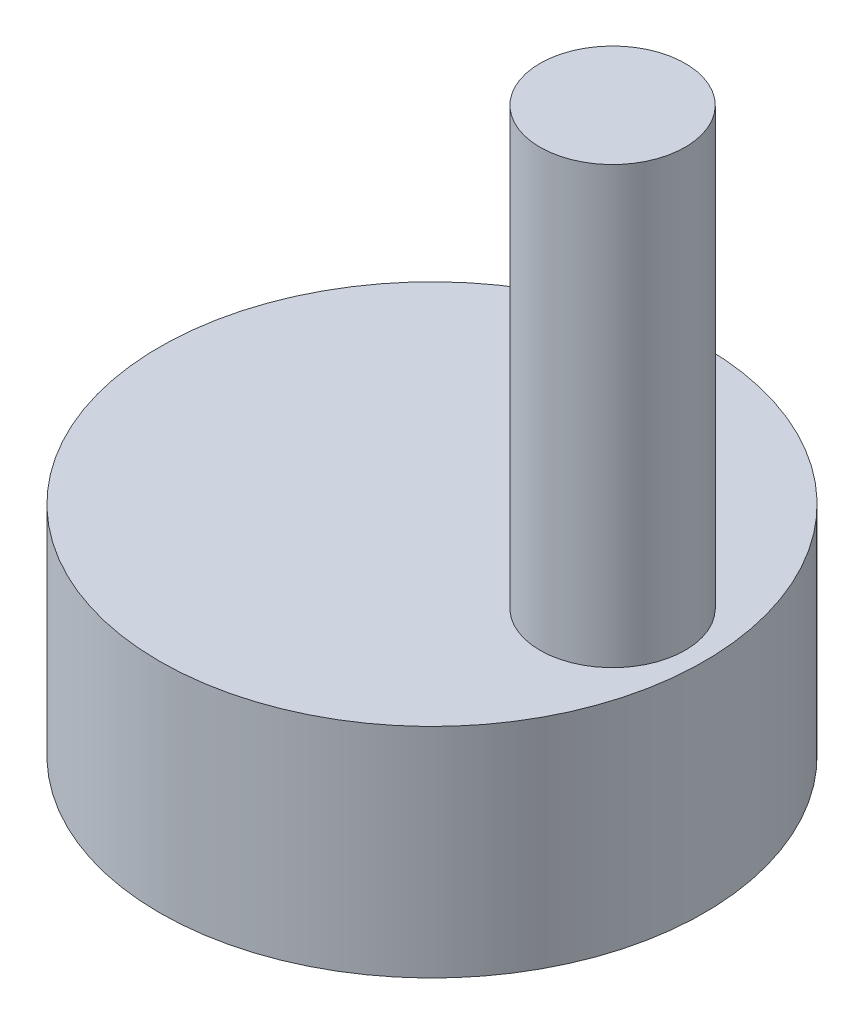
SolidWorks part; units mm, degrees
ref_plane "Front Plane" through (0, 0, 0) normal (0, 0, 1) x (1, 0, 0)
ref_plane "Top Plane" through (0, 0, 0) normal (0, 1, 0) x (1, 0, 0)
ref_plane "Right Plane" through (0, 0, 0) normal (1, 0, 0) x (0, 0, -1)
sketch "Sketch1" plane through (0, 0, 0) normal (0, 1, 0) x (1, 0, 0)
  circle A0 centre (0, 0) radius 3.75
  dimension "D1" = 7.5
extrude "Boss-Extrude1" add sketch "Sketch1" along normal blind 3
sketch "Sketch2" plane through (0, 3, 0) normal (0, 1, 0) x (1, 0, 0)
  line L0 (0, 0) -> (2.4868, 0) construction
  circle A0 centre (2.4868, 0) radius 1
  dimension "D1" = 2
  dimension "D2" = 2.4868
extrude "Boss-Extrude2" add sketch "Sketch2" along normal blind 6
